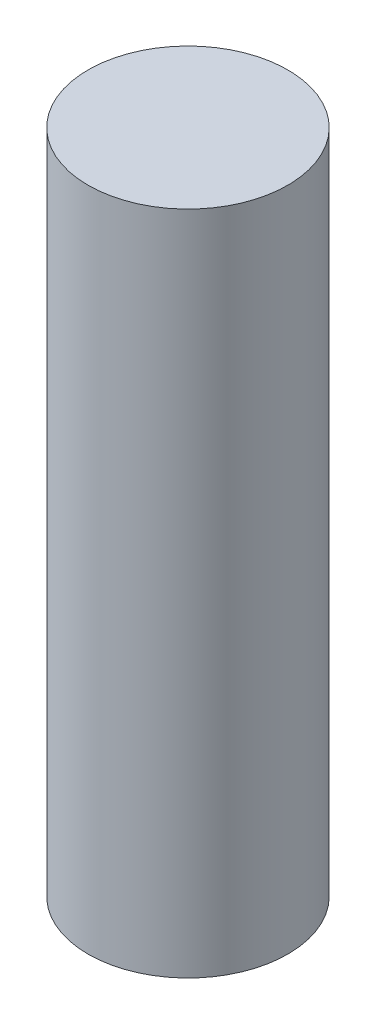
SolidWorks part; units mm, degrees
ref_plane "Front Plane" through (0, 0, 0) normal (0, 0, 1) x (1, 0, 0)
ref_plane "Top Plane" through (0, 0, 0) normal (0, 1, 0) x (1, 0, 0)
ref_plane "Right Plane" through (0, 0, 0) normal (1, 0, 0) x (0, 0, -1)
sketch "Sketch1" plane through (0, 0, 0) normal (0, 1, 0) x (1, 0, 0)
  circle A0 centre (-9.6542, 1.5688) radius 15
extrude "Boss-Extrude1" add sketch "Sketch1" along normal blind 100
